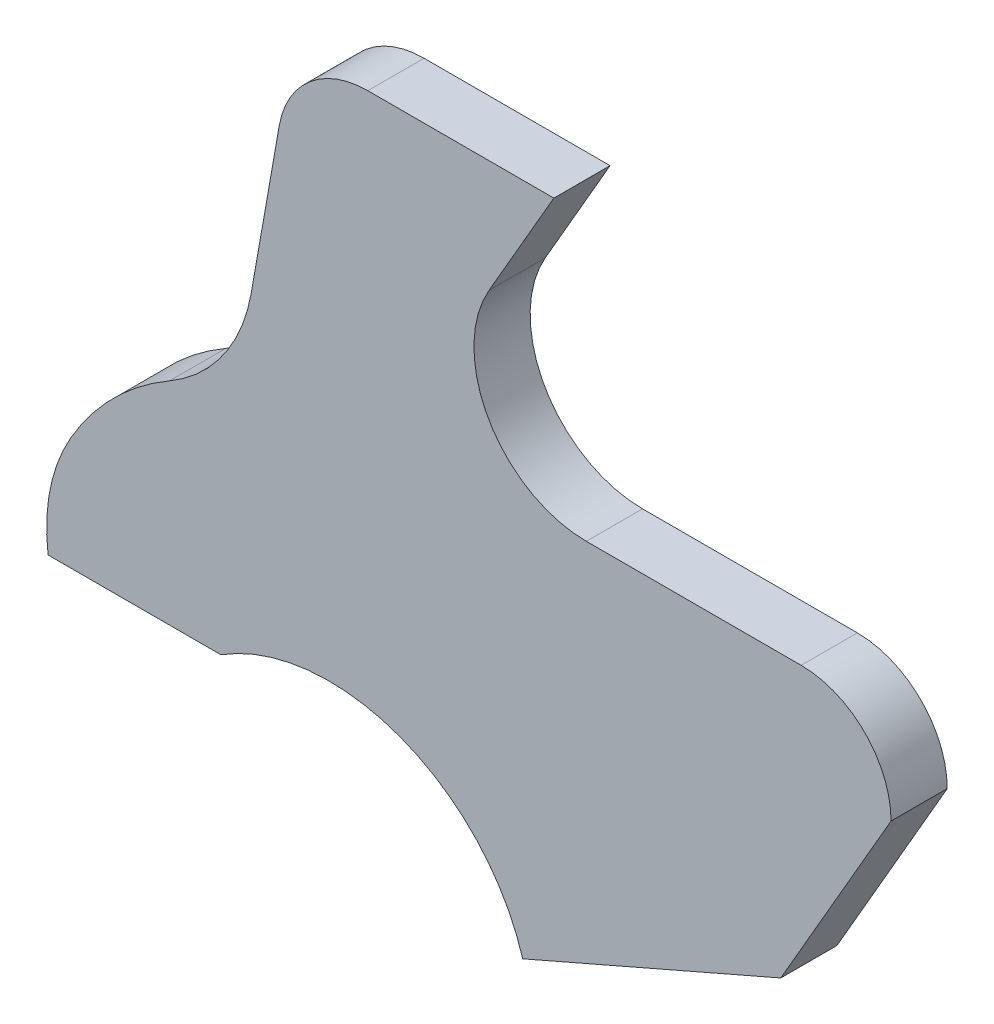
SolidWorks part; units mm, degrees
ref_plane "Plan de face" through (0, 0, 0) normal (0, 0, 1) x (1, 0, 0)
ref_plane "Plan de dessus" through (0, 0, 0) normal (0, 1, 0) x (1, 0, 0)
ref_plane "Plan de droite" through (0, 0, 0) normal (1, 0, 0) x (0, 0, -1)
sketch "Esquisse1" plane through (0, 0, 0) normal (0, 0, 1) x (1, 0, 0)
  line L0 (0, 0) -> (-30.7442, 0)
  line L1 (10.4, 86.7784) -> (5.3971, 58.4058)
  line L2 (26.1569, 100) -> (59.2558, 100)
  line L3 (59.2558, 100) -> (47.7088, 80)
  line L4 (65.0293, 50) -> (103.2558, 50)
  line L5 (119.2558, 34) -> (99.6259, 0)
  line L6 (99.6259, 0) -> (53.7156, -20)
  line L7 (119.2558, 34) -> (119.2558, -8.1272) construction
  line L8 (59.2558, 100) -> (111.0086, 100) construction
  line L9 (5.3971, 58.4058) -> (5.3971, 98.5075) construction
  line L10 (0.9965, 4.0653) -> (-26.7163, 20.0653) construction
  line L11 (14.8529, -3.9347) -> (-9.1471, 37.6345) construction
  arc A0 (0, 0) -> (53.7156, -20) centre (19.2558, -30.4174) cw
  arc A1 (5.3971, 58.4058) -> (-9.1471, 37.6345) centre (-24.1471, 63.6152) cw
  arc A2 (-30.7442, 0) -> (-26.7163, 20.0653) centre (0.9965, 4.0653) cw
  arc A3 (10.4, 86.7784) -> (26.1569, 100) centre (26.1569, 84) cw
  arc A4 (47.7088, 80) -> (65.0293, 50) centre (65.0293, 70) ccw
  arc A5 (103.2558, 50) -> (119.2558, 34) centre (103.2558, 34) cw
  arc A6 (-26.7163, 20.0653) -> (-9.1471, 37.6345) centre (14.8529, -3.9347) cw
  dimension "D1" = 36
  dimension "D7" = 16
  dimension "D8" = 20
  dimension "D9" = 16
  dimension "D10" = 10
  dimension "D11" = 120
  dimension "D12" = 30
  dimension "D17" = 32
  dimension "D18" = 48
  dimension "D19" = 30
  dimension "D2" = 50
  dimension "D3" = 150
  dimension "D4" = 20
  dimension "D5" = 20
  dimension "D6" = 50
  dimension "D13" = 120
  dimension "D14" = 90
  dimension "D15" = 30
  dimension "D16" = 30
extrude "Boss.-Extru.1" add sketch "Esquisse1" along normal blind 10
